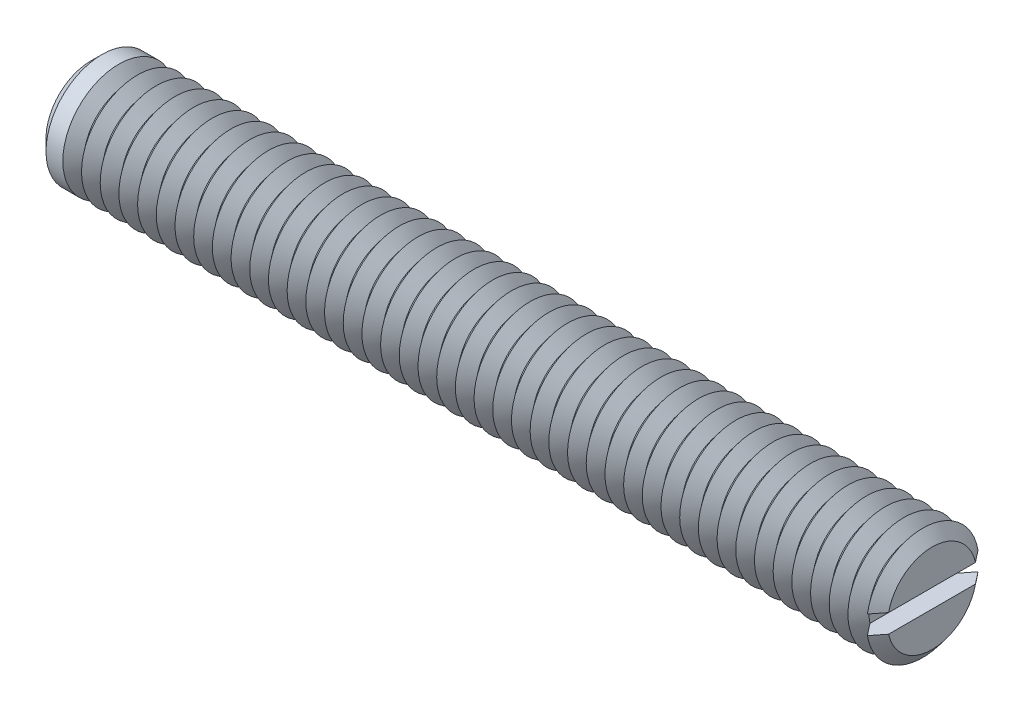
SolidWorks part; units mm, degrees
ref_plane "Front Plane" through (0, 0, 0) normal (0, 0, 1) x (1, 0, 0)
ref_plane "Top Plane" through (0, 0, 0) normal (0, 1, 0) x (1, 0, 0)
ref_plane "Right Plane" through (0, 0, 0) normal (1, 0, 0) x (0, 0, -1)
sketch "Sketch1" plane through (0, 0, 0) normal (1, 0, 0) x (0, 0, -1)
  circle A0 centre (0, 0) radius 3
  dimension "D1" = 6
extrude "Extrude1" add sketch "Sketch1" along normal mid plane 45
sketch "Sketch2" plane through (0, 0, 0) normal (0, 0, 1) x (1, 0, 0)
  line L0 (22.5, 0.5) -> (21.5, 0.5)
  line L1 (22.5, -3) -> (22.5, 3) construction
  line L2 (21.5, 0.5) -> (21.5, -0.5)
  line L3 (0, 0) -> (50000, 0) construction
  line L4 (22.5, -0.5) -> (21.5, -0.5)
  line L5 (22.5, -0.5) -> (22.5, 0.5)
  point P9 (21.5, 0)
  dimension "D1" = 1
extrude "Extrude2" cut sketch "Sketch2" against normal mid plane 9
chamfer "Chamfer1" distance 0.6 angle 45 1 edges at (-22.5, 0, -3)
sketch "Sketch3" plane through (0, 0, 0) normal (0, 0, 1) x (1, 0, 0)
  line L0 (0, 0) -> (30.9602, 0) construction
  line L1 (22, -3) -> (23, -3)
  line L2 (-21.9, -3) -> (22.5, -3) construction
  line L3 (23, -3) -> (22.5, -2.3755)
  line L4 (22.5, -3) -> (22.5, -0.5) construction
  line L5 (22.5, -2.3755) -> (22, -3)
  dimension "D1" = 1
  dimension "D2" = 0.8
revolve "Cut-Revolve1" cut sketch "Sketch3" angle 360 about L0
pattern_linear "LPattern1" count 44 spacing 1 along (-1, 0, 0) of "Cut-Revolve1"
equation "\"D2@Sketch3\" = \"D1@Sketch3\"*0.8"
